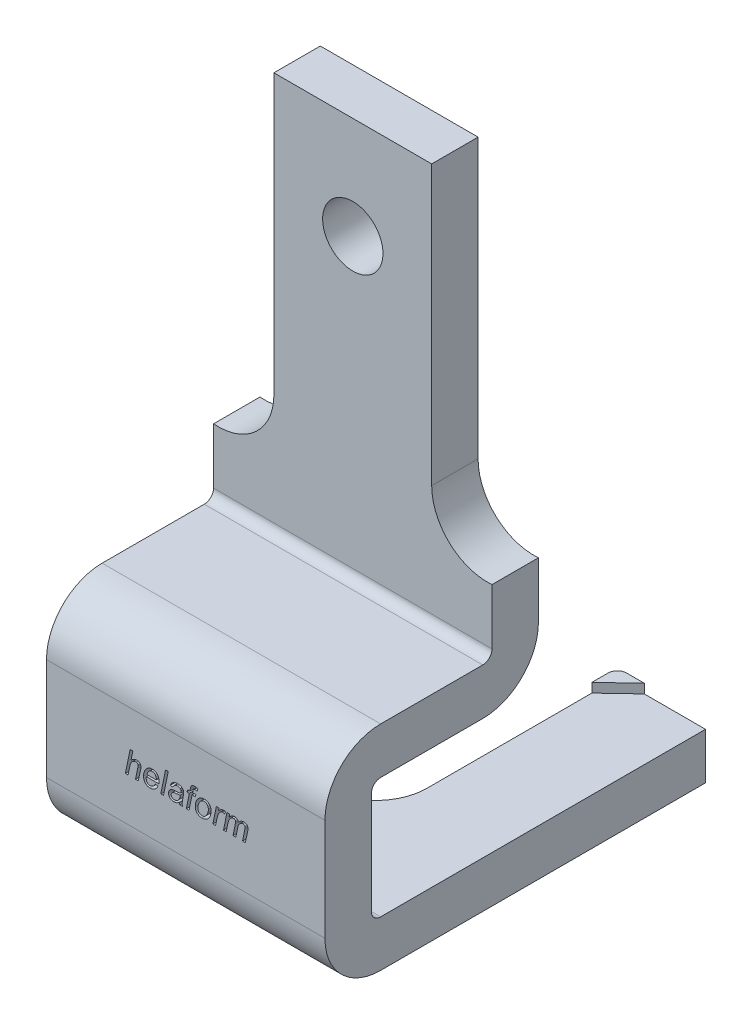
SolidWorks part; units mm, degrees
ref_plane "Front" through (0, 0, 0) normal (0, 0, 1) x (1, 0, 0)
ref_plane "Top" through (0, 0, 0) normal (0, 1, 0) x (1, 0, 0)
ref_plane "Right" through (0, 0, 0) normal (1, 0, 0) x (0, 0, -1)
sketch "Sketch1" plane through (0, 0, 0) normal (1, 0, 0) x (0, 0, -1)
  line L0 (0, 0) -> (0, -42)
  line L1 (-1, -43) -> (-12, -43)
  line L2 (-18, -49) -> (-18, -60)
  line L3 (-12, -66) -> (23, -66)
  line L4 (5, 0) -> (5, -42)
  line L5 (-1, -48) -> (-12, -48)
  line L6 (-13, -49) -> (-13, -60)
  line L7 (-12, -61) -> (23, -61)
  line L8 (0, 0) -> (5, 0)
  line L9 (23, -61) -> (23, -66)
  arc A0 (0, -42) -> (-1, -43) centre (-1, -42) cw
  arc A1 (-12, -43) -> (-18, -49) centre (-12, -49) ccw
  arc A2 (-18, -60) -> (-12, -66) centre (-12, -60) ccw
  arc A3 (5, -42) -> (-1, -48) centre (-1, -42) cw
  arc A4 (-12, -48) -> (-13, -49) centre (-12, -49) ccw
  arc A5 (-13, -60) -> (-12, -61) centre (-12, -60) ccw
  dimension "D2" = 6
  dimension "D3" = 18
  dimension "D6" = 1
  dimension "D1" = 66
  dimension "D4" = 41
  dimension "D5" = 23
  dimension "D7" = 5
extrude "Extrude1" add sketch "Sketch1" along normal blind 30
sketch "Sketch4" plane through (0, -66, 0) normal (0, -1, 0) x (1, 0, 0)
  line L0 (15, -23) -> (15, 12) construction
  line L1 (30, -23) -> (0, -23) construction
  line L2 (30, 12) -> (0, 12) construction
  line L3 (9.5, -23) -> (9.5, -2.5)
  line L4 (20.5, -2.5) -> (20.5, -23)
  line L5 (9.5, -23) -> (20.5, -23)
  arc A0 (9.5, -2.5) -> (20.5, -2.5) centre (15, -2.5) cw
  dimension "D1" = 5.5
  dimension "D2" = 26
extrude "Extrude4" cut sketch "Sketch4" against normal up to next
fillet "Fillet2" radius 1 2 edges at (9.5, -63.5, -23) (20.5, -63.5, -23)
sketch "Sketch5" plane through (0, -61, 0) normal (0, 1, 0) x (1, 0, 0)
  line L0 (30, -12) -> (0, -12) construction
  line L1 (15, -12) -> (15, 23.8589) construction
  line L2 (23.4044, 23) -> (20.5, 20.2497)
  line L3 (30, 23) -> (21.5, 23) construction
  line L4 (6.5956, 23) -> (8.5, 23)
  line L5 (20.5, 2.5) -> (20.5, 22) construction
  line L6 (20.5, 20.2497) -> (20.5, 22)
  line L7 (23.4044, 23) -> (21.5, 23)
  line L8 (9.5, 20.2497) -> (9.5, 22)
  line L9 (6.5956, 23) -> (9.5, 20.2497)
  arc A0 (21.5, 23) -> (20.5, 22) centre (21.5, 22) ccw construction
  arc A1 (21.5, 23) -> (20.5, 22) centre (21.5, 22) ccw
  arc A2 (8.5, 23) -> (9.5, 22) centre (8.5, 22) cw
  dimension "D1" = 4
  dimension "D2" = 1.9044
extrude "Extrude5" add sketch "Sketch5" along normal blind 1
sketch "Sketch6" plane through (0, 0, -5) normal (0, 0, -1) x (-1, 0, 0)
  line L0 (-30, 0) -> (0, 0) construction
  line L1 (-15, 0) -> (-15, -42) construction
  line L2 (-30, -42) -> (0, -42) construction
  line L3 (-6.5, 0) -> (-6.5, -30.0209)
  line L4 (0, -42) -> (0, 0) construction
  line L5 (-30, 0) -> (-23.5, 0)
  line L6 (0, -36) -> (0, 0)
  line L7 (-30, -42) -> (-30, 0) construction
  line L8 (-30, -36) -> (-30, 0)
  line L9 (-23.5, 0) -> (-23.5, -30.0209)
  line L10 (-6.5, 0) -> (0, 0)
  arc A0 (-6.5, -30.0209) -> (0, -36) centre (-0.5, -30.0209) ccw
  arc A1 (-23.5, -30.0209) -> (-30, -36) centre (-29.5, -30.0209) cw
  dimension "D2" = 6
  dimension "D1" = 36
  dimension "D3" = 6.5
extrude "Extrude6" cut sketch "Sketch6" against normal up to next
sketch "Sketch7" plane through (0, 0, -5) normal (0, 0, -1) x (-1, 0, 0)
  line L0 (-23.5, 0) -> (-6.5, 0) construction
  circle A0 centre (-15, -11) radius 3.25
  point P2 (-15, 0)
  dimension "D1" = 6.5
  dimension "D2" = 11
extrude "Extrude7" cut sketch "Sketch7" against normal up to next
sketch "Sketch8" plane through (0, 0, 18) normal (0, 0, 1) x (1, 0, 0)
  line L0 (0, -54.5) -> (30, -54.5) construction
  line L1 (30, -49) -> (0, -49) construction
  line L2 (30, -60) -> (0, -60) construction
  line L3 (15, -49) -> (15, -60) construction
  line L4 (30, -49) -> (30, -60) construction
  line L5 (0, -49) -> (0, -60) construction
  text T0 "helaform" font "Arial" height 2.5
extrude "Cut-Extrude1" cut sketch "Sketch8" against normal blind 1
